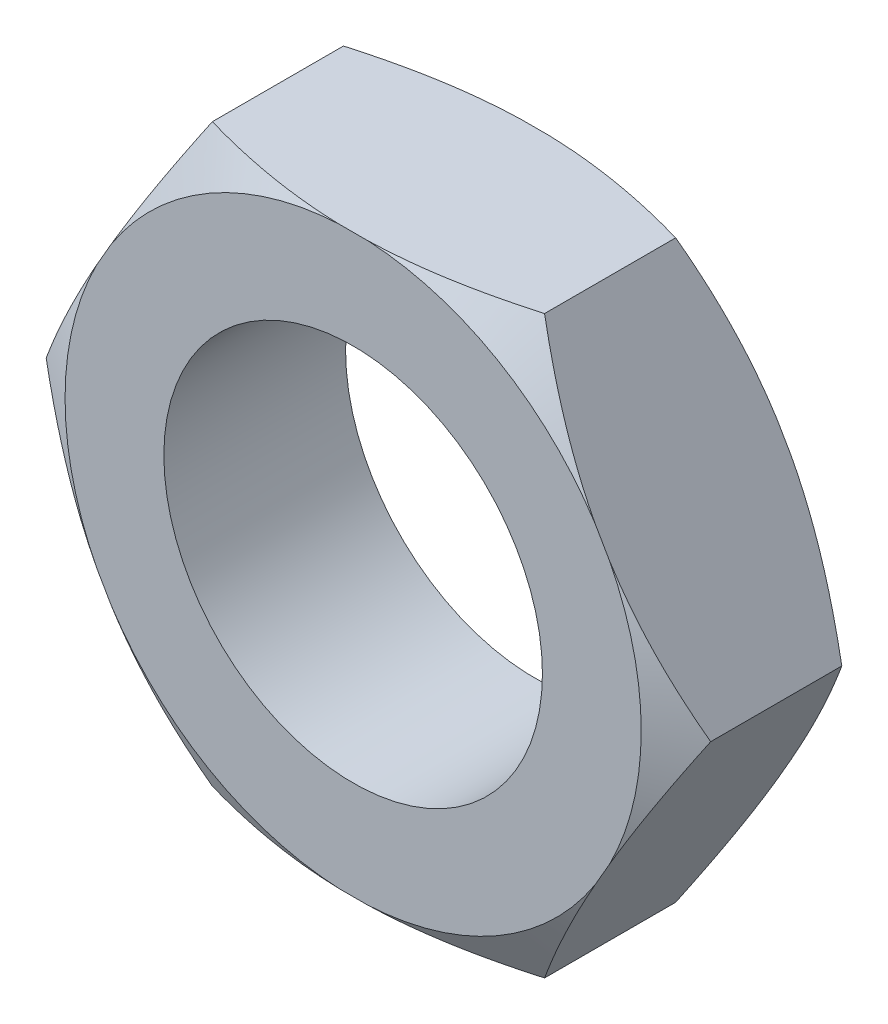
SolidWorks part; units mm, degrees
ref_plane "Front" through (0, 0, 0) normal (0, 0, 1) x (1, 0, 0)
ref_plane "Top" through (0, 0, 0) normal (0, 1, 0) x (1, 0, 0)
ref_plane "Right" through (0, 0, 0) normal (1, 0, 0) x (0, 0, -1)
sketch "Sketch2" plane through (0, 0, 0) normal (0, 0, 1) x (1, 0, 0)
  line L1 (4.1794, -7.239) -> (8.3589, 0)
  line L2 (8.3589, 0) -> (4.1794, 7.239)
  line L3 (4.1794, 7.239) -> (-4.1794, 7.239)
  line L4 (-4.1794, 7.239) -> (-8.3589, 0)
  line L5 (-8.3589, 0) -> (-4.1794, -7.239)
  line L6 (-4.1794, -7.239) -> (4.1794, -7.239)
  circle A0 centre (0, 0) radius 4.7625
  circle A1 centre (0, 0) radius 7.239 construction
  dimension "缸径" = 9.525
  dimension "螺母大径" = 14.478
extrude "Base-Extrude" add sketch "Sketch2" along normal mid plane 4.572
sketch "Sketch4" plane through (0, 0, 0) normal (0, 1, 0) x (1, 0, 0)
  line L0 (0, 3.558) -> (0, -4.5381) construction
  line L1 (0, -2.286) -> (0, 2.286) construction
  line L2 (8.9057, 0) -> (2.7758, 0) construction
  line L3 (7.2479, 2.286) -> (8.3589, 1.6496)
  line L4 (8.3589, 2.286) -> (4.1794, 2.286) construction
  line L5 (8.3589, -2.286) -> (8.3589, 2.286) construction
  line L6 (7.2479, -2.286) -> (8.3589, -1.6496)
  line L7 (8.3589, 1.6496) -> (8.3589, 2.286)
  line L8 (8.3589, -1.6496) -> (8.3589, -2.286)
  line L9 (8.3589, 2.286) -> (7.2479, 2.286)
  line L10 (8.3589, -2.286) -> (7.2479, -2.286)
revolve "Cut-Revolve1" cut sketch "Sketch4" angle 360 about L0
